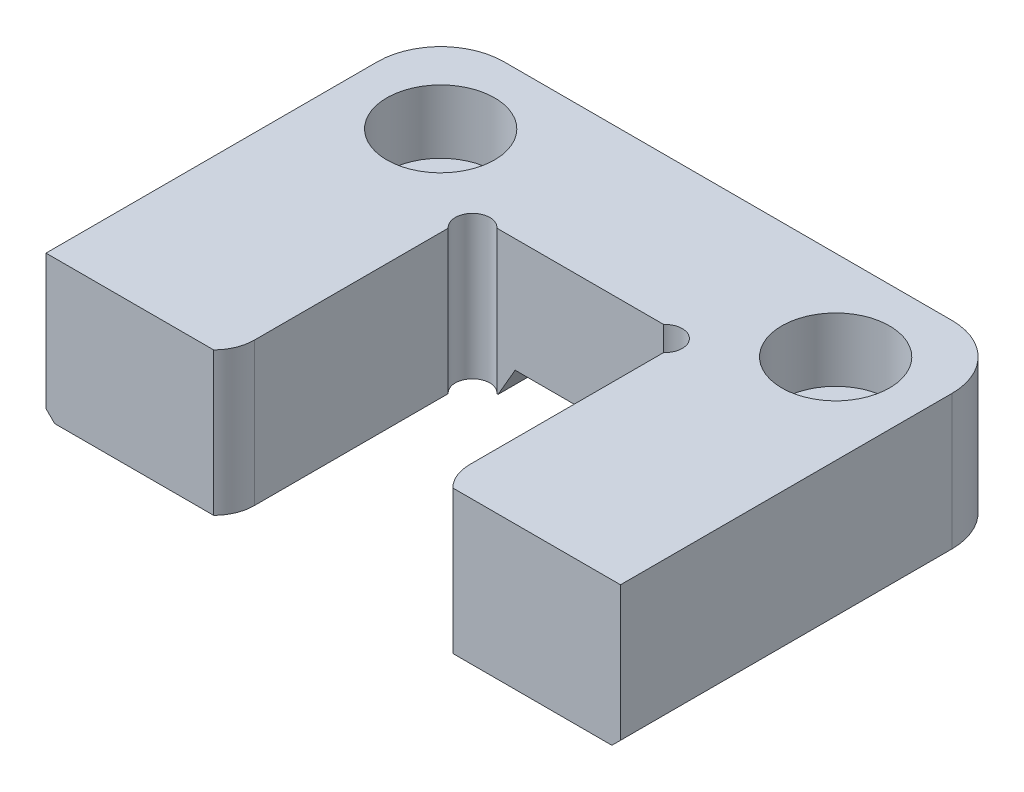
SolidWorks part; units mm, degrees
ref_plane "Front Plane" through (0, 0, 0) normal (0, 0, 1) x (1, 0, 0)
ref_plane "Top Plane" through (0, 0, 0) normal (0, 1, 0) x (1, 0, 0)
ref_plane "Right Plane" through (0, 0, 0) normal (1, 0, 0) x (0, 0, -1)
sketch "Sketch1" plane through (0, 0, 0) normal (0, 1, 0) x (1, 0, 0)
  line L0 (0, 0) -> (0, 50000) construction
  line L1 (0, 0) -> (50000, 0) construction
  line L2 (9.525, 0) -> (25.4, 0)
  line L3 (-25.4, 0) -> (-9.525, 0)
  line L4 (-25.4, 0) -> (-25.4, 34.8996)
  line L5 (-25.4, 34.8996) -> (25.4, 34.8996)
  line L6 (25.4, 0) -> (25.4, 34.8996)
  line L8 (-9.525, 0) -> (-9.525, 21.844)
  line L9 (-9.525, 21.844) -> (9.525, 21.844)
  line L10 (9.525, 0) -> (9.525, 21.844)
  dimension "D1" = 34.8996
  dimension "D2" = 50.8
  dimension "D3" = 19.05
  dimension "D4" = 21.844
extrude "Boss-Extrude1" add sketch "Sketch1" against normal blind 12.6746 separate body
fillet "Fillet1" radius 5.588 2 edges at (25.4, -6.3373, -34.8996) (-25.4, -6.3373, -34.8996)
sketch "Sketch2" plane through (0, 0, 0) normal (0, 1, 0) x (1, 0, 0)
  line L0 (0, 0) -> (0, 50000) construction
  line L1 (-9.525, 0) -> (-9.525, 21.844) construction
  line L2 (-25.4, 0) -> (-9.525, 0) construction
  line L3 (-9.525, 2.54) -> (-9.525, 12.7)
  line L4 (-15.875, 0) -> (-10.5774, 0)
  line L5 (15.875, 0) -> (15.875, -12.7)
  line L6 (-15.875, -12.7) -> (15.875, -12.7)
  line L7 (-9.525, 12.7) -> (9.525, 12.7)
  line L8 (-15.875, 0) -> (-15.875, -12.7)
  line L9 (15.875, 0) -> (10.5774, 0)
  line L10 (9.525, 2.54) -> (9.525, 12.7)
  arc A0 (-9.855, 0.5195) -> (-10.5774, 0) centre (-10.5774, 0.762) cw construction
  arc A1 (9.855, 0.5195) -> (9.525, 2.54) centre (15.875, 2.54) cw construction
  arc A2 (-9.855, 0.5195) -> (-9.525, 2.54) centre (-15.875, 2.54) ccw construction
  arc A3 (9.855, 0.5195) -> (10.5774, 0) centre (10.5774, 0.762) ccw construction
  arc A4 (10.5774, 0) -> (9.525, 2.54) centre (13.1164, 2.54) cw
  arc A5 (-10.5774, 0) -> (-9.525, 2.54) centre (-13.1164, 2.54) ccw
  point P14 (0, -12.7)
  point P24 (0, 12.7)
  dimension "D1" = 0.762
  dimension "D2" = 6.35
  dimension "D3" = 2.54
  dimension "D4" = 12.7
  dimension "D5" = 12.7
extrude "Cut-Extrude1" cut sketch "Sketch2" against normal through all
sketch "Sketch3" plane through (0, 0, 0) normal (0, 1, 0) x (1, 0, 0)
  line L2 (-10.033, 2.54) -> (-10.033, 21.844)
  line L3 (-10.033, 2.54) -> (-10.033, 21.844) construction
  line L4 (0, 0) -> (0, 50000) construction
  line L5 (-9.525, 22.352) -> (9.525, 22.352)
  line L6 (-9.525, 22.352) -> (9.525, 22.352) construction
  circle A0 centre (-8.509, 20.828) radius 1.524
  circle A1 centre (8.509, 20.828) radius 1.524
  dimension "D3" = 1.524
  dimension "D1" = 0.508
  dimension "D2" = 0.508
extrude "Cut-Extrude2" cut sketch "Sketch3" against normal through all
sketch "Sketch5" plane through (0, 0, -34.8996) normal (0, 0, -1) x (-1, 0, 0)
  line L0 (-6.35, -11.0871) -> (6.35, -11.0871)
  line L1 (-19.812, 0) -> (19.812, 0) construction
  line L2 (0, 0) -> (0, 50000) construction
  line L3 (6.35, -11.0871) -> (7.2665, -12.6746)
  line L4 (-19.812, -12.6746) -> (19.812, -12.6746) construction
  line L5 (-7.2665, -12.6746) -> (7.2665, -12.6746)
  line L6 (-6.35, -11.0871) -> (-7.2665, -12.6746)
  point P4 (0, 0)
  point P12 (0, -12.6746)
  point P13 (0, -11.0871)
  dimension "D1" = 30
  dimension "D2" = 1.5875
  dimension "D3" = 12.7
extrude "Cut-Extrude3" cut sketch "Sketch5" against normal through all
chamfer "Chamfer1" distance 0.762 angle 45 6 edges at (13.5393, -12.6746, -34.8996) (23.7633, -12.6746, -33.2629) (25.4, -12.6746, -14.6558) (-13.5393, -12.6746, -34.8996) (-23.7633, -12.6746, -33.2629) (-25.4, -12.6746, -14.6558)
chamfer "Chamfer5" distance 3.81 angle 15 1 edges at (0, -11.0871, -21.844)
hole_wizard "#10 CBORE" positions "Sketch7" profile "Sketch6" counterbore size "#10" standard "Ansi Inch"
sketch "Sketch7" plane through (9.0831, 0, -5.226) normal (0, 1, 0) x (-1, 0, 0)
  line L0 (9.0831, 0) -> (9.0831, 50000) construction
  line L1 (-10.7289, -29.6736) -> (28.8951, -29.6736) construction
  line L2 (34.4831, -24.0856) -> (34.4831, 5.226) construction
  point P0 (26.5456, -21.7361)
  point P11 (-8.3794, -21.7361)
  dimension "D1" = 7.9375
  dimension "D2" = 7.9375
sketch "Sketch6" plane through (-17.4625, 0, -26.9621) normal (1, 0, 0) x (0, 0, 1)
  line L0 (0, 0) -> (0, 12.6746)
  line L1 (0, 12.6746) -> (2.5527, 12.6746)
  line L3 (2.5527, 12.6746) -> (2.5527, 5.6197)
  line L4 (2.5527, 5.6197) -> (4.7625, 5.6197)
  line L5 (4.7625, 5.6197) -> (4.7625, 0)
  line L7 (4.7625, 0) -> (0, 0)
  line L11 (0, -6.35) -> (0, 107.95) construction
  dimension "Thru Hole Dia." = 5.1054
  dimension "Thru Hole Depth" = 12.6746
  dimension "C'Bore Dia." = 9.525
  dimension "C'Bore Depth" = 5.6197
